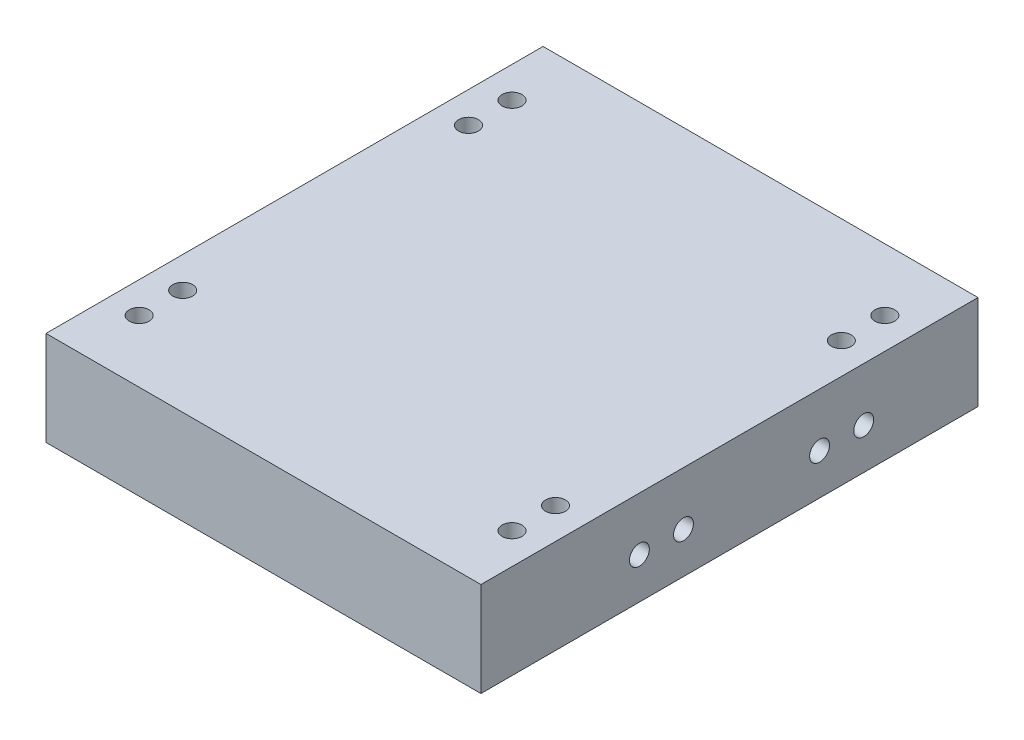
SolidWorks part; units mm, degrees
ref_plane "Front Plane" through (0, 0, 0) normal (0, 0, 1) x (1, 0, 0)
ref_plane "Top Plane" through (0, 0, 0) normal (0, 1, 0) x (1, 0, 0)
ref_plane "Right Plane" through (0, 0, 0) normal (1, 0, 0) x (0, 0, -1)
sketch "Sketch1" plane through (0, 0, 0) normal (0, 1, 0) x (1, 0, 0)
  line L1 (-22.225, 25.4) -> (22.225, 25.4)
  line L2 (-22.225, 25.4) -> (-22.225, -25.4)
  line L3 (-22.225, -25.4) -> (22.225, -25.4)
  line L4 (22.225, 25.4) -> (22.225, -25.4)
  line L5 (-22.225, 25.4) -> (22.225, -25.4) construction
  line L6 (-22.225, -25.4) -> (22.225, 25.4) construction
  point P0 (0, 0)
extrude "Boss-Extrude1" add sketch "Sketch1" along normal blind 9.652
sketch "Sketch2" plane through (0, 9.652, 0) normal (0, 1, 0) x (1, 0, 0)
  circle A0 centre (-19.05, 19.05) radius 1.016
  circle A1 centre (19.05, 19.05) radius 1.016
  circle A2 centre (19.05, -19.05) radius 1.016
  circle A6 centre (-19.05, -19.05) radius 1.016
extrude "Cut-Extrude1" cut sketch "Sketch2" against normal through all
sketch "Sketch13" plane through (-22.225, 0, 0) normal (-1, 0, 0) x (0, 0, 1)
  circle A0 centre (-13.716, 4.191) radius 1.016
  circle A1 centre (4.699, 4.191) radius 1.016
extrude "Cut-Extrude2" cut sketch "Sketch13" against normal blind 10.16
sketch "Sketch18" plane through (22.225, 0, 0) normal (1, 0, 0) x (0, 0, -1)
  circle A0 centre (13.716, 4.191) radius 1.016
  circle A1 centre (-4.699, 4.191) radius 1.016
extrude "Cut-Extrude3" cut sketch "Sketch18" against normal blind 10.16
sketch "Sketch21" plane through (0, 9.652, 0) normal (0, 1, 0) x (1, 0, 0)
  circle A1 centre (-19.05, 14.605) radius 1.016
  circle A2 centre (19.05, 14.605) radius 1.016
  circle A5 centre (-19.05, -14.605) radius 1.016
  circle A6 centre (19.05, -14.605) radius 1.016
  point P0 (0, 0)
extrude "Cut-Extrude4" cut sketch "Sketch21" against normal through all
sketch "Sketch24" plane through (22.225, 0, 0) normal (1, 0, 0) x (0, 0, -1)
  circle A2 centre (9.2075, 4.191) radius 1.016
  circle A3 centre (-9.2075, 4.191) radius 1.016
extrude "Cut-Extrude5" cut sketch "Sketch24" against normal blind 10.16
sketch "Sketch25" plane through (-22.225, 0, 0) normal (-1, 0, 0) x (0, 0, 1)
  circle A2 centre (-9.2075, 4.191) radius 1.016
  circle A3 centre (9.2075, 4.191) radius 1.016
extrude "Cut-Extrude6" cut sketch "Sketch25" against normal blind 10.16
